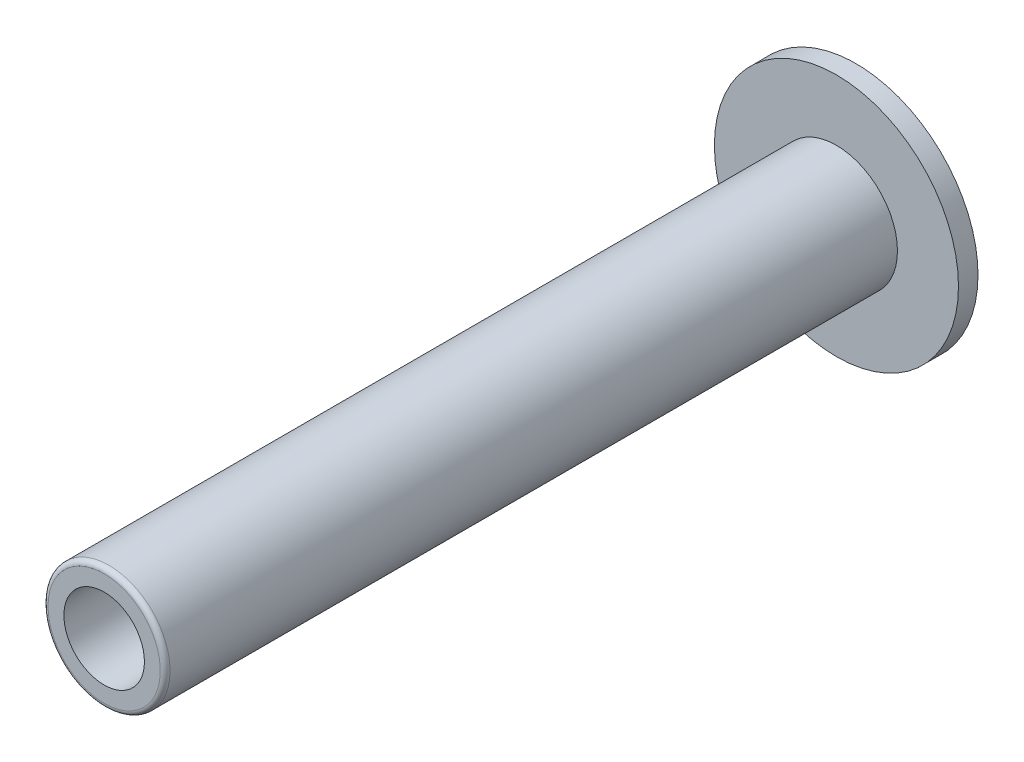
SolidWorks part; units mm, degrees
ref_plane "Plan de face" through (0, 0, 0) normal (0, 0, 1) x (1, 0, 0)
ref_plane "Plan de dessus" through (0, 0, 0) normal (0, 1, 0) x (1, 0, 0)
ref_plane "Plan de droite" through (0, 0, 0) normal (1, 0, 0) x (0, 0, -1)
sketch "Esquisse1" plane through (0, 0, 0) normal (1, 0, 0) x (0, 0, -1)
  line L0 (-35.4075, 0) -> (9.5183, 0) construction
  line L1 (0, 2.5) -> (0, 5)
  line L2 (-30, 2.5) -> (0, 2.5)
  line L3 (-30, 2.5) -> (-30, 0)
  line L4 (-30, 0) -> (2.2, 0)
  line L7 (2.2, 0) -> (2.2, 3.9854) construction
  line L8 (0, 5) -> (0.8, 5)
  arc A0 (0.8, 5) -> (2.2, 0) centre (-7.4286, 0) cw
  point P7 (2.115, 0)
  dimension "D1" = 5
  dimension "D2" = 2.2
  dimension "D3" = 30
  dimension "D4" = 10
  dimension "D6" = 0.8
revolve "Révolution1" add sketch "Esquisse1" angle 360 about L0
fillet "Congé1" radius 0.2 1 edges at (2.5, 0, 30)
ref_plane "Plan1" through (0, 0, -2.2) normal (0, 0, -1) x (-1, 0, 0)
sketch "Esquisse2" plane through (0, 0, -2.2) normal (0, 0, -1) x (-1, 0, 0)
  line L0 (0.5, 0.5) -> (6, 0.5)
  line L1 (-6, -0.5) -> (-0.5, -0.5)
  line L2 (-6, -0.5) -> (-6, 0.5)
  line L3 (-6, 0.5) -> (-0.5, 0.5)
  line L4 (6, -0.5) -> (6, 0.5)
  line L5 (-6, -0.5) -> (6, 0.5) construction
  line L6 (-6, 0.5) -> (6, -0.5) construction
  line L7 (-0.5, 2) -> (0.5, 2)
  line L8 (-0.5, 2) -> (-0.5, 0.5)
  line L9 (-0.5, -2) -> (0.5, -2)
  line L10 (0.5, 2) -> (0.5, 0.5)
  line L11 (-0.5, 2) -> (0.5, -2) construction
  line L12 (-0.5, -2) -> (0.5, 2) construction
  line L13 (0.5, -0.5) -> (0.5, -2)
  line L14 (-0.5, -0.5) -> (-0.5, -2)
  line L15 (0.5, -0.5) -> (6, -0.5)
  point P0 (0, 0)
  point P6 (0, 0)
  dimension "D1" = 1
  dimension "D2" = 1
  dimension "D3" = 4
  dimension "D4" = 12
extrude "Enlèv. mat.-Extru.1" cut sketch "Esquisse2" against normal blind 1
hole_wizard "Trou taraudé M41" positions "Esquisse3" profile "Esquisse4" tap size "M4" standard "ISO"
sketch "Esquisse3" plane through (0, 0, 30) normal (0, 0, 1) x (1, 0, 0)
  point P0 (0, 0)
sketch "Esquisse4" plane through (0, 0, 30) normal (1, 0, 0) x (0, -1, 0)
  line L0 (0, 0) -> (0, 20.9914)
  line L1 (0, 20.9914) -> (1.65, 20)
  line L2 (1.65, 20) -> (1.65, 0)
  line L5 (1.65, 0) -> (0, 0)
  line L10 (0, 20.9914) -> (-1.65, 20) construction
  line L11 (0, -6.35) -> (0, 107.95) construction
  dimension "Diamètre du trou pour taraudage" = 3.3
  dimension "Profondeur du trou pour taraudage" = 20
  dimension "Angle de pointe" = 118
